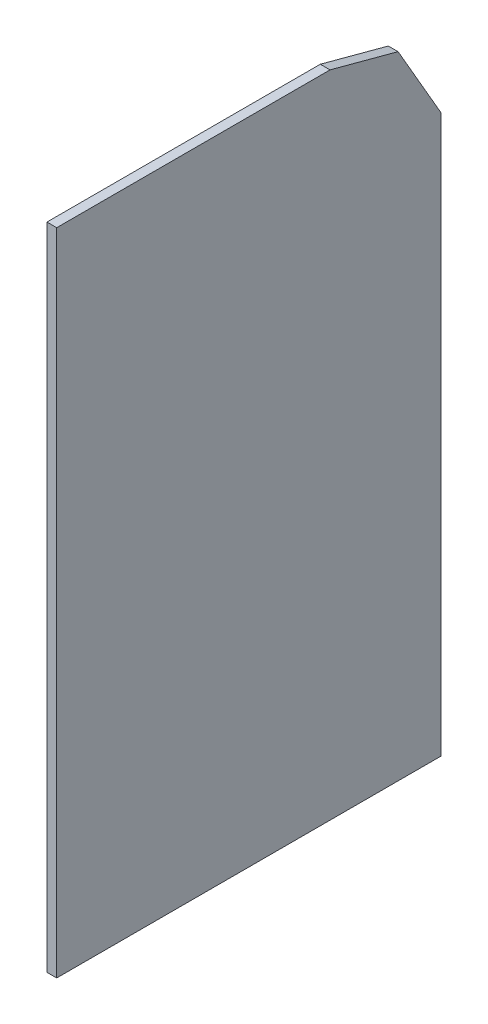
SolidWorks part; units mm, degrees
ref_plane "Front Plane" through (0, 0, 0) normal (1, 0, 0) x (0, 1, 0)
ref_plane "Top Plane" through (0, 0, 0) normal (0, 0, 1) x (0, 1, 0)
ref_plane "Right Plane" through (0, 0, 0) normal (0, 1, 0) x (-1, 0, 0)
sketch "Sketch1" plane through (0, 0, 0) normal (0, 1, 0) x (-1, 0, 0)
  line L1 (-38.1, 1500) -> (38.1, 1500)
  line L2 (-38.1, 1500) -> (-38.1, -1500)
  line L3 (-38.1, -1500) -> (38.1, -1500)
  line L4 (38.1, 1500) -> (38.1, -1500)
  line L5 (-38.1, 1500) -> (38.1, -1500) construction
  line L6 (-38.1, -1500) -> (38.1, 1500) construction
  point P0 (0, 0)
  dimension "D1" = 3000
  dimension "D2" = 76.2
extrude "Boss-Extrude1" add sketch "Sketch1" along normal blind 5101.6125
ref_plane "Mating plane" through (0, 0, -1750) normal (0, 0, -1) x (0, 1, 0)
chamfer "Chamfer1" distance 30 angle 45 4 edges at (0, 0, 1500) (38.1, 0, 0) (0, 0, -1500) (-38.1, 0, 0)
sketch "Sketch2" plane through (0, 0, 0) normal (1, 0, 0) x (0, 1, 0)
  line L0 (3419.5899, -530.6022) -> (5737.6689, -530.6022)
  line L1 (5101.6125, 1500) -> (30, 1500) construction
  dimension "D1" = 2030.6022
sketch "Sketch4" plane through (0, 0, 0) normal (1, 0, 0) x (0, 1, 0)
  line L8 (3419.5899, -530.6022) -> (5737.6689, -530.6022) construction
  line L13 (5101.6125, 1500) -> (5101.6125, -1500) construction
  line B0 (3768.8489, -1500) -> (4381.1797, -1500)
  line B1 (4381.1797, -1500) -> (4960.5952, -1165.4743)
  line B2 (4960.5952, -1165.4743) -> (5130.7087, -530.6022)
  line B3 (5130.7087, -530.6022) -> (5351.6125, -530.6022)
  line B4 (3768.8489, -1500) -> (3768.8489, -1982.6996)
  line B5 (3768.8489, -1982.6996) -> (5351.6125, -1982.6996)
  line B6 (5351.6125, -1982.6996) -> (5351.6125, -530.6022)
  line B7 (5130.7087, -530.6022) -> (5101.6125, -480.2062)
  line B8 (5101.6125, -480.2062) -> (5101.6125, -376.29)
sketch_block_instance "Block2-1"
sketch_block "Block2" parameters "D1"=250
sketch "Sketch5" plane through (0, 0, 0) normal (1, 0, 0) x (0, 1, 0)
  line L3 (5101.6125, -633.395) -> (5101.6125, -1500)
  line L4 (5101.6125, -1500) -> (4380.4297, -1500)
  line L6 (5101.6125, 1500) -> (5101.6125, -1500) construction
  line L9 (4380.4297, -1498.701) -> (4380.4297, -1500)
  line L11 (4959.3071, -1164.4859) -> (5129.2598, -530.214)
  line L12 (4380.4297, -1498.701) -> (4959.3071, -1164.4859)
  line L13 (4959.3071, -1164.4859) -> (5101.6125, -633.395)
  line L14 (4380.4297, -1498.701) -> (4959.3071, -1164.4859)
  line L15 (5101.6125, -1500) -> (30, -1500) construction
  dimension "D1" = 1.5
extrude "Cut-Extrude1" cut sketch "Sketch5" against normal through all both and the other way through all
